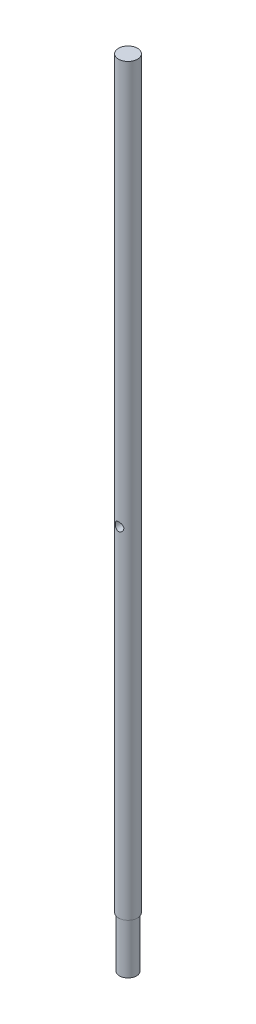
SolidWorks part; units mm, degrees
ref_plane "Front Plane" through (0, 0, 0) normal (0, 0, 1) x (1, 0, 0)
ref_plane "Top Plane" through (0, 0, 0) normal (0, 1, 0) x (1, 0, 0)
ref_plane "Right Plane" through (0, 0, 0) normal (1, 0, 0) x (0, 0, -1)
sketch "Sketch1" plane through (0, 0, 0) normal (0, 1, 0) x (1, 0, 0)
  circle A0 centre (0, 0) radius 4.7625
extrude "Extrude1" add sketch "Sketch1" along normal blind 398.78
sketch "Sketch2" plane through (0, 0, 0) normal (0, 0, 1) x (1, 0, 0)
  line L0 (4.7625, 398.78) -> (-4.7625, 398.78) construction
  circle A0 centre (0, 195.58) radius 2.1526
  dimension "D1" = 4.3053
  dimension "D2" = 203.2
extrude "Cut-Extrude1" cut sketch "Sketch2" against normal through all and the other way through all
sketch "Sketch3" plane through (0, 0, 0) normal (0, -1, 0) x (1, 0, 0)
  circle A0 centre (0, 0) radius 4.312
  circle A1 centre (0, 0) radius 4.7625
extrude "Cut-Extrude2" cut sketch "Sketch3" against normal blind 25.4
ref_plane "Plane1" through (0, 0, 22.225) normal (0, 0, 1) x (1, 0, 0)
